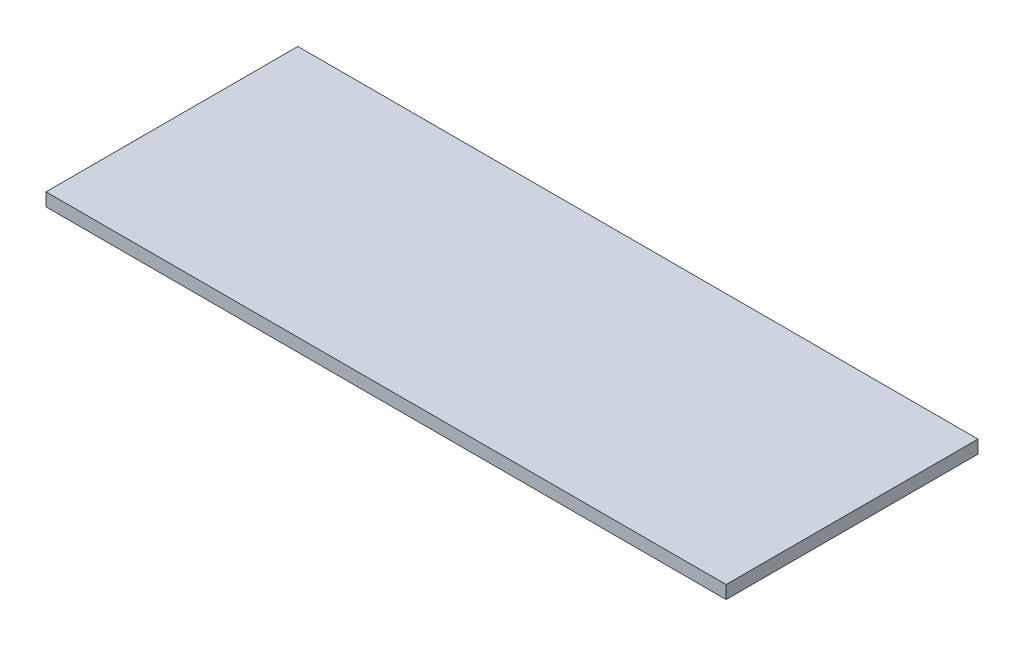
SolidWorks part; units mm, degrees
ref_plane "Front Plane" through (0, 0, 0) normal (0, 0, 1) x (1, 0, 0)
ref_plane "Top Plane" through (0, 0, 0) normal (0, 1, 0) x (1, 0, 0)
ref_plane "Right Plane" through (0, 0, 0) normal (1, 0, 0) x (0, 0, -1)
sketch "Sketch1" plane through (0, 0, 0) normal (0, 1, 0) x (1, 0, 0)
  line L1 (-76.2, 28.2194) -> (76.2, 28.2194)
  line L2 (-76.2, 28.2194) -> (-76.2, -28.2194)
  line L3 (-76.2, -28.2194) -> (76.2, -28.2194)
  line L4 (76.2, 28.2194) -> (76.2, -28.2194)
  line L5 (-76.2, 28.2194) -> (76.2, -28.2194) construction
  line L6 (-76.2, -28.2194) -> (76.2, 28.2194) construction
  point P0 (0, 0)
  dimension "D1" = 56.4388
  dimension "D2" = 152.4
extrude "Boss-Extrude1" add sketch "Sketch1" along normal blind 2.921
equation "\"thickness_acrylic0.1\"=0.1in"
equation "\"motor offset\"=6mm"
equation "\"thickness0.25\"=0.225in"
equation "\"thickness0.125\"=0.122in"
